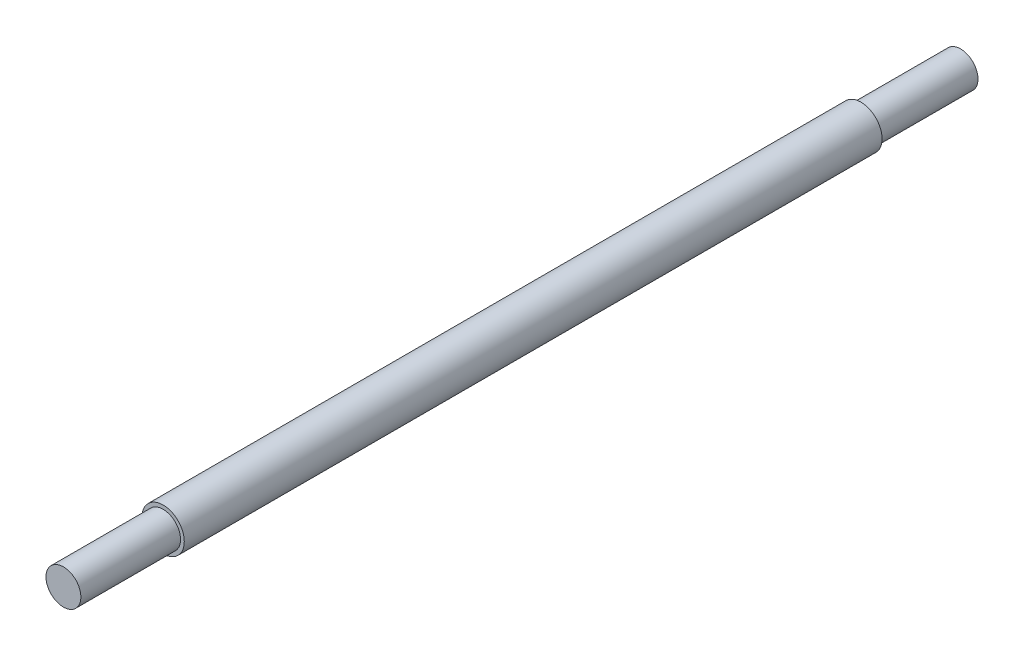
SolidWorks part; units mm, degrees
ref_plane "Plane1" through (0, 0, 0) normal (0, 0, 1) x (1, 0, 0)
ref_plane "Plane2" through (0, 0, 0) normal (0, 1, 0) x (1, 0, 0)
ref_plane "Plane3" through (0, 0, 0) normal (1, 0, 0) x (0, 0, -1)
sketch "Sketch1" plane through (0, 0, 0) normal (0, 0, 1) x (1, 0, 0)
  circle A0 centre (0, 0) radius 42.5
  dimension "D1" = 85
extrude "Base-Extrude" add sketch "Sketch1" along normal mid plane 1400
sketch "Sketch2" plane through (0, 0, 0) normal (0, 0, 1) x (1, 0, 0)
  circle A0 centre (0, 0) radius 35
  circle A1 centre (0, 0) radius 42.5 construction
  dimension "D1" = 70
extrude "Boss-Extrude1" add sketch "Sketch2" along normal mid plane 1800
